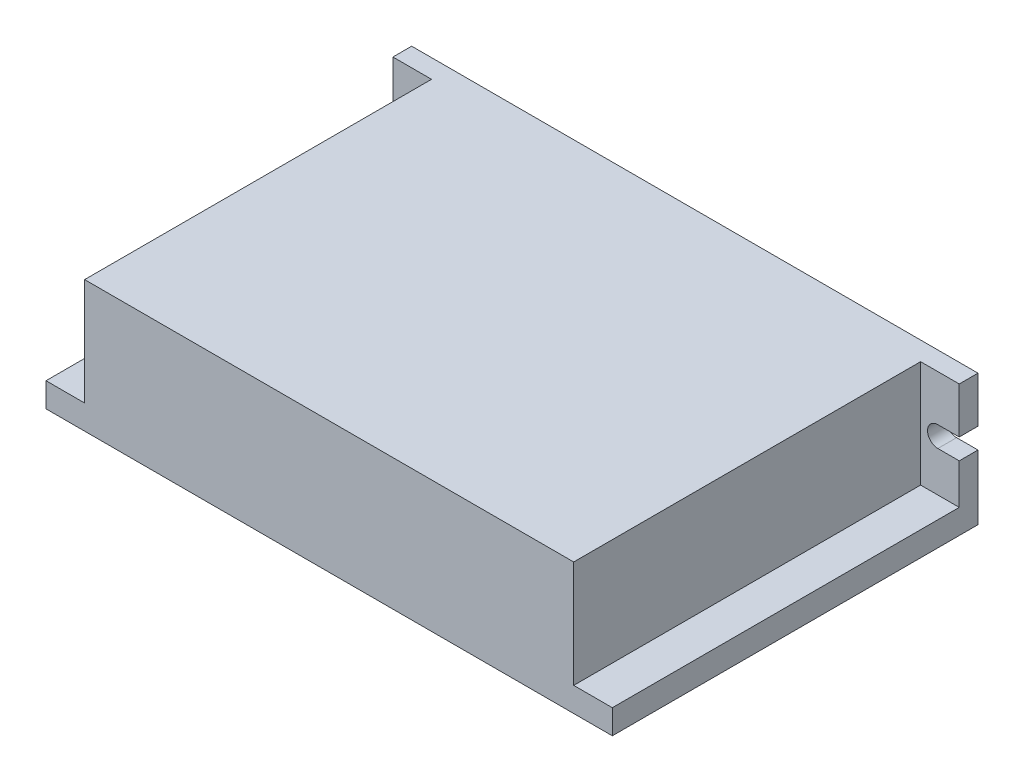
SolidWorks part; units mm, degrees
ref_plane "前视" through (0, 0, 0) normal (0, 0, 1) x (1, 0, 0)
ref_plane "上视" through (0, 0, 0) normal (0, 1, 0) x (1, 0, 0)
ref_plane "右视" through (0, 0, 0) normal (1, 0, 0) x (0, 0, -1)
sketch "草图1" plane through (0, 0, 0) normal (0, 1, 0) x (1, 0, 0)
  line L1 (0, 0) -> (151, 0)
  line L2 (0, 0) -> (0, 97.5)
  line L3 (0, 97.5) -> (151, 97.5)
  line L4 (151, 0) -> (151, 97.5)
extrude "凸台-拉伸1" add sketch "草图1" along normal blind 52
sketch "草图2" plane through (0, 0, 0) normal (0, 0, 1) x (1, 0, 0)
  line L1 (0, 52) -> (10.3, 52)
  line L2 (0, 52) -> (0, 23.5)
  line L3 (0, 23.5) -> (10.3, 23.5)
  line L4 (10.3, 52) -> (10.3, 23.5)
  line L5 (151, 52) -> (140.7, 52)
  line L6 (151, 52) -> (151, 23.5)
  line L7 (151, 23.5) -> (140.7, 23.5)
  line L8 (140.7, 52) -> (140.7, 23.5)
extrude "切除-拉伸1" cut sketch "草图2" against normal blind 92.5
ref_plane "基准面1" through (0, 0, -92.5) normal (0, 0, 1) x (1, 0, 0)
sketch "草图3" plane through (0, 0, -92.5) normal (0, 0, 1) x (1, 0, 0)
  line L0 (151, 23.5) -> (151, 52) construction
  line L1 (145.3, 39.75) -> (151, 39.75)
  line L3 (145.3, 34.25) -> (151, 34.25)
  line L4 (151, 39.75) -> (151, 34.25)
  line L5 (0, 52) -> (0, 23.5) construction
  line L6 (5.7, 39.75) -> (0, 39.75)
  line L8 (5.7, 34.25) -> (0, 34.25)
  line L9 (0, 39.75) -> (0, 34.25)
  arc A0 (145.3, 39.75) -> (145.3, 34.25) centre (145.3, 37) ccw
  arc A1 (5.7, 39.75) -> (5.7, 34.25) centre (5.7, 37) cw
extrude "切除-拉伸2" cut sketch "草图3" against normal blind 5
sketch "草图4" plane through (0, 0, 0) normal (0, 1, 0) x (1, 0, 0)
  line L1 (0, 0) -> (151, 0)
  line L2 (0, 0) -> (0, 97.5)
  line L3 (0, 97.5) -> (151, 97.5)
  line L4 (151, 0) -> (151, 97.5)
extrude "切除-拉伸3" cut sketch "草图4" along normal blind 17
